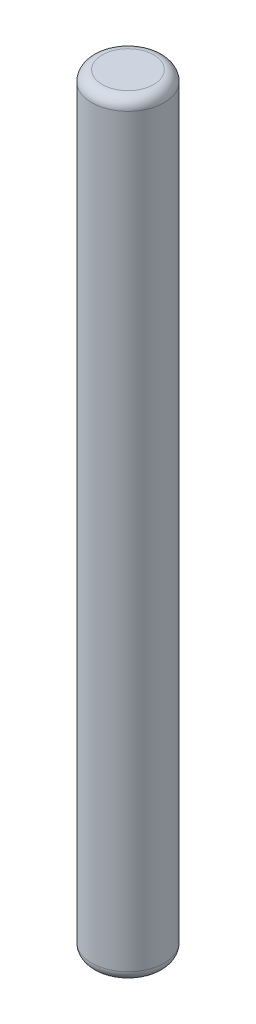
SolidWorks part; units mm, degrees
ref_plane "Plan de face" through (0, 0, 0) normal (0, 0, 1) x (1, 0, 0)
ref_plane "Plan de dessus" through (0, 0, 0) normal (0, 1, 0) x (1, 0, 0)
ref_plane "Plan de droite" through (0, 0, 0) normal (1, 0, 0) x (0, 0, -1)
sketch "Esquisse1" plane through (0, 0, 0) normal (0, 1, 0) x (1, 0, 0)
  circle A0 centre (0, 0) radius 3.45
  dimension "D1" = 6.9
extrude "Boss.-Extru.1" add sketch "Esquisse1" along normal blind 73
fillet "Congé1" radius 1 2 edges at (0, 73, 3.45) (0, 0, 3.45)
